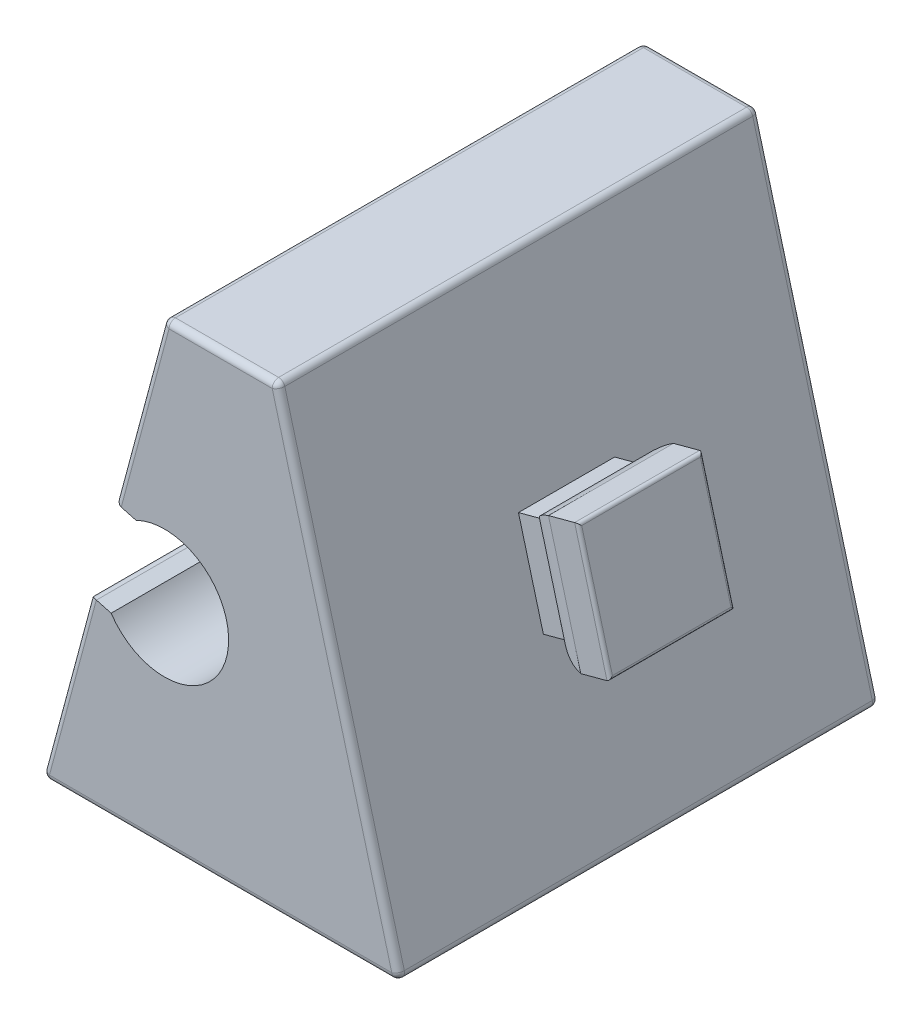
SolidWorks part; units mm, degrees
ref_plane "前视基准面" through (0, 0, 0) normal (0, 0, 1) x (1, 0, 0)
ref_plane "上视基准面" through (0, 0, 0) normal (0, 1, 0) x (1, 0, 0)
ref_plane "右视基准面" through (0, 0, 0) normal (1, 0, 0) x (0, 0, -1)
sketch "草图1" plane through (0, 0, 0) normal (0, 0, 1) x (1, 0, 0)
  line L0 (0, -7.0692) -> (0, 22.431) construction
  line L1 (-5.6, 0) -> (5.6, 0)
  line L2 (-5.6, 0) -> (-1.763, 14.32)
  line L3 (-1.763, 14.32) -> (1.763, 14.32)
  line L4 (5.6, 0) -> (1.763, 14.32)
  point P7 (0, 0)
  point P9 (0, 14.32)
extrude "凸台-拉伸1" add sketch "草图1" along normal blind 15
sketch "草图2" plane through (0, 0, 15) normal (0, 0, 1) x (1, 0, 0)
  line L1 (-1.763, 14.32) -> (-5.6, 0) construction
  line L2 (-3.6815, 7.16) -> (-4.0697, 5.7111)
  line L3 (-3.6815, 7.16) -> (-3.2933, 8.6089)
  line L4 (-4.0697, 5.7111) -> (-3.4157, 5.5359)
  line L5 (-3.2933, 8.6089) -> (-2.6392, 8.4336)
  arc A0 (-3.4157, 5.5359) -> (-2.6392, 8.4336) centre (-1.7496, 6.6424) ccw
  dimension "D1" = 2
  dimension "D2" = 1.5
  dimension "D3" = 90
  dimension "D4" = 1.5
  dimension "D5" = 2
  dimension "D6" = 1.5
extrude "切除-拉伸1" cut sketch "草图2" against normal blind 15
sketch "草图5" plane through (5.2249, 1.4, 0) normal (0.9659, 0.2588, 0) x (0, 0, -1)
  line L4 (-9, 7.4632) -> (-6, 7.4632)
  line L5 (-6, 7.4632) -> (-6, 4.4632)
  line L6 (-9, 7.4632) -> (-9, 4.4632)
  line L7 (-9, 4.4632) -> (-6, 4.4632)
  point P12 (-9, 5.9632)
extrude "凸台-拉伸2" add sketch "草图5" along normal blind 0.68
sketch "草图6" plane through (-1.1552, 4.3111, 0) normal (0.2588, -0.9659, 0) x (0.9659, 0.2588, 0)
  line L0 (7.9092, 5.55) -> (6.9648, 5.55)
  line L1 (6.0863, 9) -> (6.0863, 6)
  line L2 (7.9092, 5.55) -> (7.9092, 9.45)
  line L4 (7.9092, 9.45) -> (6.9648, 9.45)
  arc A0 (6.9648, 9.45) -> (6.0863, 9) centre (7.4092, 7.5) ccw
  arc A1 (6.9648, 5.55) -> (6.0863, 6) centre (7.4092, 7.5) cw
  point P1 (7.9092, 7.5)
extrude "凸台-拉伸3" add sketch "草图6" along normal blind 5 and the other way blind 5
sketch "草图7" plane through (0, 0, 9) normal (0, 0, 1) x (1, 0, 0)
  line L0 (3.4297, 10.716) -> (3.9473, 8.7841) construction
  line L3 (5.5916, 9.6906) -> (4.6794, 9.4462)
  line L4 (6.601, 5.9235) -> (5.6888, 5.6791)
  line L5 (5.1904, 11.1878) -> (5.5916, 9.6906)
  line L6 (5.1904, 11.1878) -> (7.7786, 1.5285) construction
  line L7 (6.601, 5.9235) -> (7.7786, 1.5285)
  line L8 (4.7238, 5.8864) -> (6.0179, 1.0567) construction
  line L9 (6.0179, 1.0567) -> (6.8664, 1.2841) construction
  line L10 (4.2782, 10.9434) -> (3.4297, 10.716) construction
  line L11 (6.8664, 1.2841) -> (7.7786, 1.5285) construction
  line L13 (5.1904, 11.1878) -> (4.2782, 10.9434) construction
  line L14 (3.4297, 10.716) -> (3.9473, 8.7841)
  line L16 (4.7238, 5.8864) -> (6.0179, 1.0567)
  line L17 (6.0179, 1.0567) -> (6.8664, 1.2841)
  line L18 (4.2782, 10.9434) -> (3.4297, 10.716)
  line L19 (6.8664, 1.2841) -> (7.7786, 1.5285)
  line L21 (5.1904, 11.1878) -> (4.2782, 10.9434)
  arc A0 (4.6794, 9.4462) -> (3.9473, 8.7841) centre (5.6133, 7.6776) ccw
  arc A1 (5.6888, 5.6791) -> (4.7238, 5.8864) centre (5.6133, 7.6776) cw
  point P10 (6.0963, 7.807)
extrude "切除-拉伸11" cut sketch "草图7" against normal blind 5 and the other way blind 5
fillet "圆角1" radius 0.2 16 edges at (-2.5281, 11.4644, 0) (-4.8349, 2.8556, 0) (0, 0, 0) (-5.6, 0, 7.5) (-4.0697, 5.7111, 7.5) (-3.2933, 8.6089, 7.5) (5.6, 0, 7.5) (0, 0, 15) (-4.8349, 2.8556, 15) (-2.5281, 11.4644, 15) (3.6815, 7.16, 15) (3.6815, 7.16, 0) (0, 14.32, 0) (-1.763, 14.32, 7.5) (1.763, 14.32, 7.5) (0, 14.32, 15)
fillet "圆角5" radius 0.1 4 edges at (6.601, 5.9235, 7.5) (6.0963, 7.807, 5.55) (5.5916, 9.6906, 7.5) (6.0963, 7.807, 9.45)
